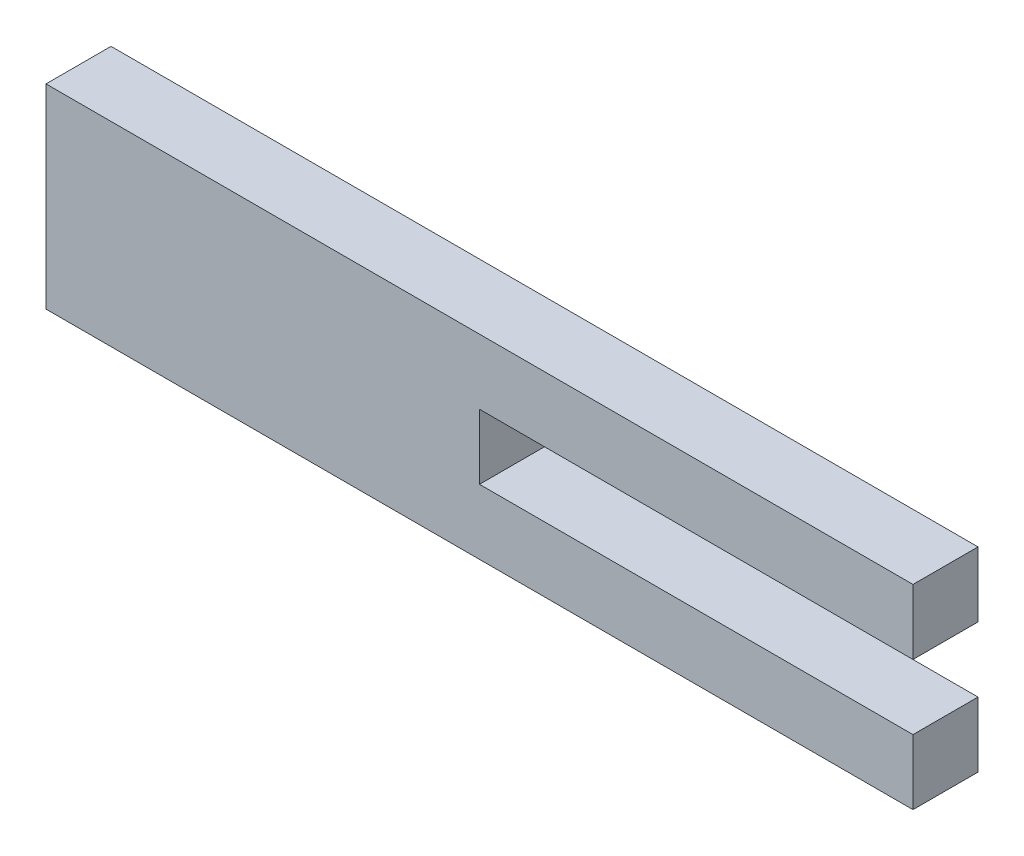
SolidWorks part; units mm, degrees
ref_plane "Alzado" through (0, 0, 0) normal (0, 0, 1) x (1, 0, 0)
ref_plane "Planta" through (0, 0, 0) normal (0, 1, 0) x (1, 0, 0)
ref_plane "Vista lateral" through (0, 0, 0) normal (1, 0, 0) x (0, 0, -1)
sketch "Croquis1" plane through (0, 0, 0) normal (0, 0, 1) x (1, 0, 0)
  line L1 (20, -4.5) -> (-20, -4.5)
  line L2 (20, -4.5) -> (20, 4.5)
  line L3 (20, 4.5) -> (-20, 4.5)
  line L4 (-20, -4.5) -> (-20, 4.5)
  line L5 (20, -4.5) -> (-20, 4.5) construction
  line L6 (20, 4.5) -> (-20, -4.5) construction
  point P0 (0, 0)
  dimension "D1" = 9
  dimension "D2" = 40
extrude "Saliente-Extruir1" add sketch "Croquis1" along normal blind 3
sketch "Croquis2" plane through (0, 0, 3) normal (0, 0, 1) x (1, 0, 0)
  line L0 (20, -1.5) -> (20, 1.5)
  line L1 (20, -1.5) -> (0, -1.5)
  line L2 (20, 1.5) -> (0, 1.5)
  line L3 (0, -1.5) -> (0, 1.5)
  line L4 (20, -4.5) -> (20, 4.5) construction
  point P6 (20, 0)
  point P7 (20, 0)
  dimension "D1" = 3
extrude "Cortar-Extruir1" cut sketch "Croquis2" against normal up to surface (3 mm away)
